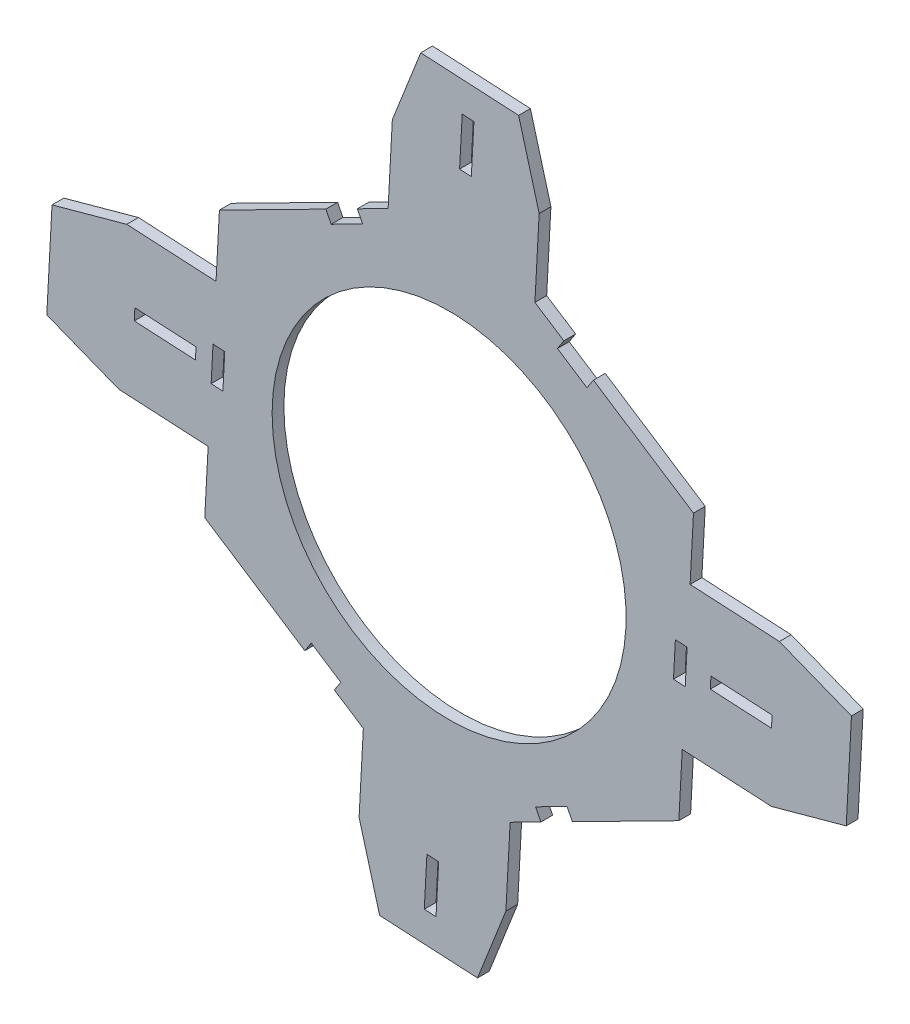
SolidWorks part; units mm, degrees
ref_plane "Front Plane" through (0, 0, 0) normal (0, 0, 1) x (1, 0, 0)
ref_plane "Top Plane" through (0, 0, 0) normal (0, 1, 0) x (1, 0, 0)
ref_plane "Right Plane" through (0, 0, 0) normal (1, 0, 0) x (0, 0, -1)
sketch "Sketch1" plane through (0, 0, 0) normal (0, 0, 1) x (1, 0, 0)
  line L0 (90.4284, 31.6568) -> (86.6282, -39.2725) construction
  line L1 (81.6815, 46.4334) -> (100.7042, 45.4142)
  line L2 (77.4111, -33.2715) -> (76.3525, -53.0299)
  line L3 (96.4338, -34.2907) -> (95.3752, -54.0491)
  line L4 (88.5283, -3.8078) -> (142.4373, -6.6961) construction
  line L5 (76.3525, -53.0299) -> (95.3752, -54.0491)
  line L6 (99.6456, 25.6558) -> (100.7042, 45.4142)
  line L7 (80.6228, 26.675) -> (81.6815, 46.4334)
  line L8 (72.5587, 22.578) -> (58.7651, 15.57)
  line L9 (72.5587, 22.578) -> (73.249, 21.2193)
  line L10 (73.249, 21.2193) -> (77.3251, 23.2902)
  line L11 (76.6348, 24.6489) -> (77.3251, 23.2902)
  line L12 (58.7651, 15.57) -> (58.3246, 7.3491)
  line L13 (140.8308, 2.9286) -> (139.8116, -16.0941)
  line L14 (58.3246, 7.3491) -> (37.245, 8.4785)
  line L15 (57.3055, -11.6736) -> (36.2258, -10.5442)
  line L16 (57.9374, 0.1204) -> (57.6927, -4.445)
  line L17 (37.245, 8.4785) -> (36.2258, -10.5442)
  line L18 (118.732, -14.9647) -> (139.8116, -16.0941)
  line L19 (119.7512, 4.058) -> (140.8308, 2.9286)
  line L20 (119.1193, -7.7361) -> (119.3639, -3.1706)
  line L36 (57.815, -2.1623) -> (59.3369, -2.2438) construction
  line L37 (57.6927, -4.445) -> (59.2146, -4.5265)
  line L38 (57.9374, 0.1204) -> (59.4592, 0.0389)
  line L39 (80.6228, 26.675) -> (76.6348, 24.6489)
  line L40 (59.2146, -4.5265) -> (59.4592, 0.0389)
  line L41 (57.3055, -11.6736) -> (56.865, -19.8946)
  line L46 (103.3943, 23.2152) -> (99.6456, 25.6558)
  line L47 (103.3943, 23.2152) -> (102.5628, 21.938)
  line L48 (102.5628, 21.938) -> (106.3943, 19.4434)
  line L49 (107.2258, 20.7206) -> (106.3943, 19.4434)
  line L50 (120.1916, 12.279) -> (107.2258, 20.7206)
  line L51 (119.7512, 4.058) -> (120.1916, 12.279)
  line L52 (119.3639, -3.1706) -> (117.8421, -3.0891)
  line L53 (117.8421, -3.0891) -> (117.5975, -7.6546)
  line L54 (119.1193, -7.7361) -> (117.5975, -7.6546)
  line L55 (118.2915, -23.1857) -> (118.732, -14.9647)
  line L56 (104.4979, -30.1936) -> (118.2915, -23.1857)
  line L57 (104.4979, -30.1936) -> (103.8076, -28.8349)
  line L58 (103.8076, -28.8349) -> (99.7315, -30.9058)
  line L59 (100.4218, -32.2645) -> (99.7315, -30.9058)
  line L60 (96.4338, -34.2907) -> (100.4218, -32.2645)
  line L61 (73.6624, -30.8308) -> (77.4111, -33.2715)
  line L62 (73.6624, -30.8308) -> (74.4939, -29.5536)
  line L63 (74.4939, -29.5536) -> (70.6624, -27.0591)
  line L64 (69.8309, -28.3362) -> (70.6624, -27.0591)
  line L65 (56.865, -19.8946) -> (69.8309, -28.3362)
  circle A0 centre (88.5283, -3.8078) radius 22.9363
  dimension "D2" = 51.8672
  dimension "D1" = 49.803
extrude "Boss-Extrude1" add sketch "Sketch1" along normal blind 1.524
chamfer "Chamfer1" distance 9.525 distance2 3.175 4 edges at (37.245, 8.4785, 0.762) (100.7042, 45.4142, 0.762) (139.8116, -16.0941, 0.762) (76.3525, -53.0299, 0.762)
chamfer "Chamfer2" distance 3.175 distance2 9.525 4 edges at (81.6815, 46.4334, 0.762) (140.8308, 2.9286, 0.762) (95.3752, -54.0491, 0.762) (36.2258, -10.5442, 0.762)
sketch "Sketch4" plane through (0, 0, 1.524) normal (0, 0, 1) x (1, 0, 0)
  line L0 (80.6228, 26.675) -> (99.6456, 25.6558) construction
  line L1 (90.1342, 26.1654) -> (90.6445, 35.6904) construction
  line L2 (119.7512, 4.058) -> (118.732, -14.9647) construction
  line L3 (96.4338, -34.2907) -> (77.4111, -33.2715) construction
  line L4 (57.3055, -11.6736) -> (58.3246, 7.3491) construction
  line L5 (57.815, -2.1623) -> (55.6975, -2.0488) construction
  line L6 (86.9224, -33.7811) -> (86.4121, -43.3061) construction
  line L7 (119.2416, -5.4534) -> (122.412, -5.6232) construction
  line L8 (90.6445, 35.6904) -> (90.9843, 42.0313) construction
  line L9 (55.6975, -2.0488) -> (47.7714, -1.6242) construction
  line L10 (86.4121, -43.3061) -> (86.0724, -49.647) construction
  line L11 (91.4054, 35.6497) -> (91.7452, 41.9906)
  line L12 (122.412, -5.6232) -> (130.3382, -6.0479) construction
  line L13 (122.3713, -6.3841) -> (130.2974, -6.8088)
  line L14 (85.6512, -43.2653) -> (85.3115, -49.6062)
  line L15 (55.7383, -1.2879) -> (47.8122, -0.8633)
  line L16 (89.8836, 35.7312) -> (90.2234, 42.0721)
  line L17 (122.4528, -4.8623) -> (130.3789, -5.287)
  line L18 (87.173, -43.3468) -> (86.8333, -49.6877)
  line L19 (55.6568, -2.8097) -> (47.7306, -2.3851)
  line L20 (91.4054, 35.6497) -> (89.8836, 35.7312)
  line L21 (91.7452, 41.9906) -> (90.2234, 42.0721)
  line L22 (122.3713, -6.3841) -> (122.4528, -4.8623)
  line L23 (130.2974, -6.8088) -> (130.3789, -5.287)
  line L24 (85.6512, -43.2653) -> (87.173, -43.3468)
  line L25 (85.3115, -49.6062) -> (86.8333, -49.6877)
  line L26 (55.7383, -1.2879) -> (55.6568, -2.8097)
  line L27 (47.8122, -0.8633) -> (47.7306, -2.3851)
  dimension "D1" = 9.525
  dimension "D2" = 0.762
  dimension "D4" = 9.525
  dimension "D5" = 6.35
  dimension "D6" = 6.35
  dimension "D3" = 0.762
extrude "Cut-Extrude1" cut sketch "Sketch4" against normal blind 2.54
